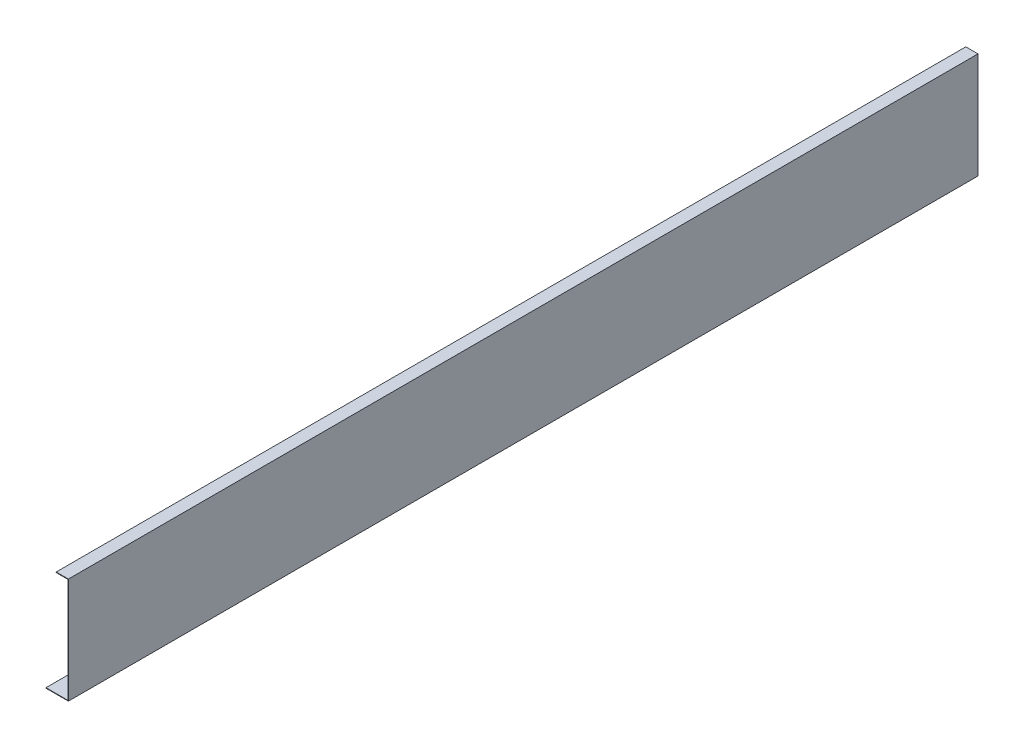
SolidWorks part; units mm, degrees
ref_plane "Plan de face" through (0, 0, 0) normal (0, 0, 1) x (1, 0, 0)
ref_plane "Plan de dessus" through (0, 0, 0) normal (0, 1, 0) x (1, 0, 0)
ref_plane "Plan de droite" through (0, 0, 0) normal (1, 0, 0) x (0, 0, -1)
sketch "Esquisse1" plane through (0, 0, 0) normal (0, 0, 1) x (1, 0, 0)
  line L0 (0, 0) -> (30, 0)
  line L1 (30, 0) -> (30, 130)
  line L2 (30, 130) -> (15, 130)
  line L3 (15, 130) -> (15, 129.35)
  line L4 (15, 129.35) -> (29.35, 129.35)
  line L5 (29.35, 129.35) -> (29.35, 0.65)
  line L6 (29.35, 0.65) -> (0.65, 0.65)
  line L7 (0, 20) -> (0, 0)
  line L9 (0, 20) -> (0.65, 20)
  line L10 (0.65, 20) -> (0.65, 0.65)
  dimension "D1" = 0.65
  dimension "D2" = 0.65
  dimension "D3" = 130
  dimension "D4" = 15
  dimension "D5" = 30
  dimension "D6" = 20
  dimension "D7" = 0.65
  dimension "D8" = 0.65
extrude "Boss.-Extru.2" add sketch "Esquisse1" along normal blind 1118
sketch "Esquisse2" plane through (0, 0, 0) normal (0, -1, 0) x (1, 0, 0)
  line L1 (0, 0) -> (2.5, 0)
  line L2 (0, 0) -> (0, 32.5)
  line L3 (0, 32.5) -> (2.5, 32.5)
  line L4 (2.5, 0) -> (2.5, 32.5)
  line L5 (0, 1118) -> (2.5, 1118)
  line L6 (0, 1118) -> (0, 1085.5)
  line L7 (0, 1085.5) -> (2.5, 1085.5)
  line L8 (2.5, 1118) -> (2.5, 1085.5)
  dimension "D1" = 2.5
  dimension "D2" = 32.5
  dimension "D3" = 2.5
  dimension "D4" = 32.5
extrude "Enlèv. mat.-Extru.1" cut sketch "Esquisse2" against normal through all
